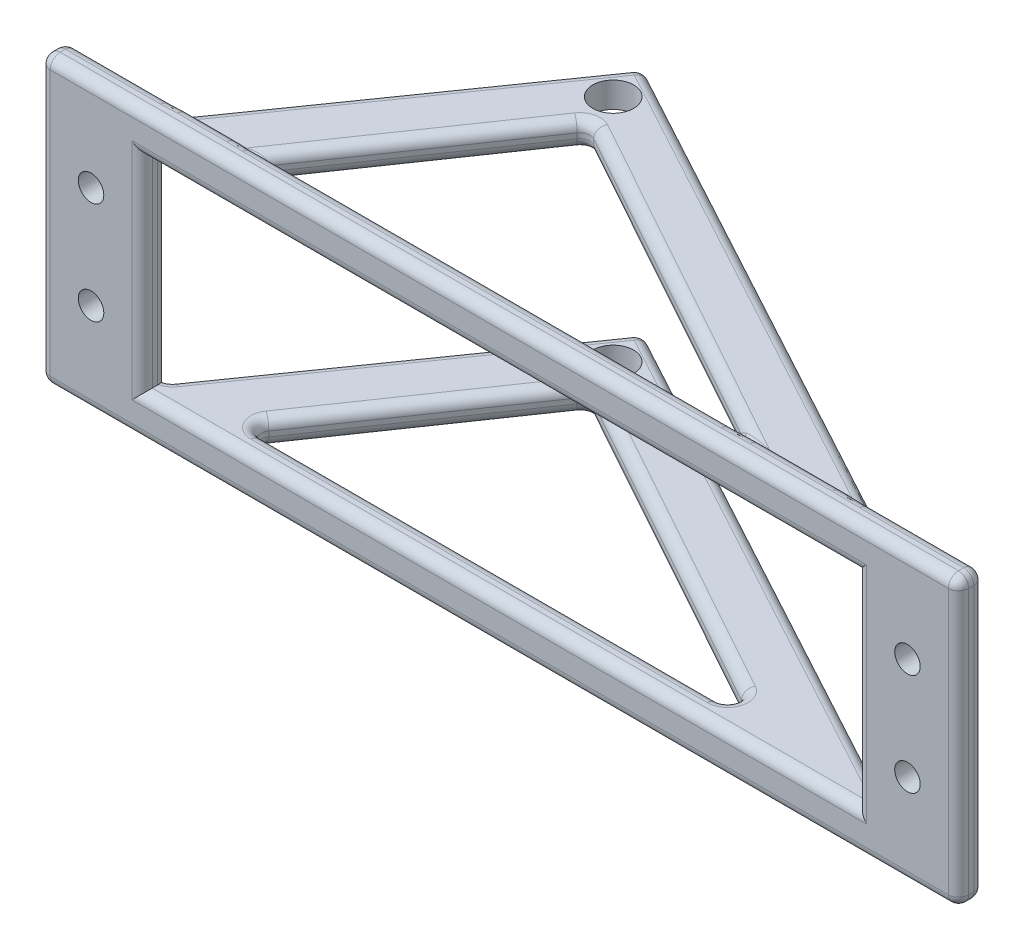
SolidWorks part; units mm, degrees
ref_plane "Front Plane" through (0, 0, 0) normal (0, 0, 1) x (1, 0, 0)
ref_plane "Top Plane" through (0, 0, 0) normal (0, 1, 0) x (1, 0, 0)
ref_plane "Right Plane" through (0, 0, 0) normal (1, 0, 0) x (0, 0, -1)
sketch "Sketch1" plane through (0, 0, 0) normal (0, 0, 1) x (1, 0, 0)
  line L1 (-114.3, 35.56) -> (114.3, 35.56)
  line L2 (-114.3, 35.56) -> (-114.3, -35.56)
  line L3 (-114.3, -35.56) -> (114.3, -35.56)
  line L4 (114.3, 35.56) -> (114.3, -35.56)
  line L5 (-114.3, 35.56) -> (114.3, -35.56) construction
  line L6 (-114.3, -35.56) -> (114.3, 35.56) construction
  point P0 (0, 0)
  dimension "D1" = 228.6
  dimension "D2" = 71.12
extrude "Boss-Extrude1" add sketch "Sketch1" along normal blind 6.35
sketch "Sketch2" plane through (0, 0, 6.35) normal (0, 0, 1) x (1, 0, 0)
  line L0 (-114.3, 0) -> (114.3, 0) construction
  line L1 (114.3, -35.56) -> (114.3, 35.56) construction
  line L2 (0, 0) -> (0, -25.4) construction
  line L3 (-88.9, 25.4) -> (88.9, 25.4)
  line L4 (-88.9, 25.4) -> (-88.9, -25.4)
  line L5 (-88.9, -25.4) -> (88.9, -25.4)
  line L6 (88.9, 25.4) -> (88.9, -25.4)
  line L7 (-88.9, 25.4) -> (88.9, -25.4) construction
  line L8 (-88.9, -25.4) -> (88.9, 25.4) construction
  circle A0 centre (-101.6, 12.7) radius 3.175
  circle A1 centre (-101.6, -12.7) radius 3.175
  circle A2 centre (101.6, -12.7) radius 3.175
  circle A3 centre (101.6, 12.7) radius 3.175
  point P0 (0, 0)
  point P6 (0, 0)
  dimension "D3" = 6.35
  dimension "D1" = 177.8
  dimension "D2" = 50.8
  dimension "D4" = 12.7
  dimension "D5" = 12.7
extrude "Cut-Extrude1" cut sketch "Sketch2" against normal through all
fillet "Fillet1" radius 2.54 12 edges at (88.9, 0, 6.35) (0, -25.4, 6.35) (0, 25.4, 6.35) (-88.9, 0, 6.35) (-114.3, 0, 6.35) (0, 35.56, 6.35) (114.3, 0, 6.35) (0, -35.56, 6.35) (114.3, 35.56, 3.175) (114.3, -35.56, 3.175) (-114.3, -35.56, 3.175) (-114.3, 35.56, 3.175)
ref_plane "Plane1" through (0, -31.75, 0) normal (0, -1, 0) x (-1, 0, 0)
sketch "Sketch3" plane through (0, -31.75, 0) normal (0, -1, 0) x (-1, 0, 0)
  line L0 (0, 0) -> (0, 69.8066) construction
  line L1 (131.9682, 69.8066) -> (-131.9682, 69.8066) construction
  line L2 (88.9, 0) -> (-88.9, 0) construction
  line L3 (111.76, 0) -> (-111.76, 0) construction
  line L4 (88.9, 0) -> (40.0209, 69.8066)
  line L5 (40.0209, 69.8066) -> (-88.9, 0)
  line L6 (70.4256, 0) -> (35.122, 51.367)
  line L7 (35.122, 51.367) -> (-57.7982, 0)
  line L8 (88.9, 0) -> (70.4256, 0)
  line L9 (-57.7982, 0) -> (-88.9, 0)
  line L10 (35.122, 51.367) -> (36.4585, 56.3977) construction
  line L11 (38.7411, 64.9897) -> (40.0209, 69.8066) construction
  point P6 (0, 69.8066)
  point P10 (0, 0)
  point P16 (87.9281, 0)
  dimension "D5" = 25.4
  dimension "D1" = 177.8
  dimension "D2" = 55
  dimension "D3" = 0.5
  dimension "D4" = 0.5
extrude "Boss-Extrude2" add sketch "Sketch3" against normal blind 6.35
ref_plane "Plane2" through (0, 1.905, 0) normal (0, -1, 0) x (-1, 0, 0)
ref_plane "Plane3" through (0, 31.75, 0) normal (0, 1, 0) x (1, 0, 0)
sketch "Sketch5" plane through (0, 31.75, 0) normal (0, 1, 0) x (1, 0, 0)
  line L0 (-88.9, 0) -> (-40.0209, 69.8066)
  line L1 (-40.0209, 69.8066) -> (88.9, 0)
  line L9 (88.9, 0) -> (57.7982, 0)
  line L10 (57.7982, 0) -> (-35.122, 51.367)
  line L11 (-35.122, 51.367) -> (-70.4256, 0)
  line L12 (-70.4256, 0) -> (-88.9, 0)
  point P8 (0, 0)
extrude "Boss-Extrude3" add sketch "Sketch5" against normal blind 6.35
sketch "Sketch7" plane through (0, -31.75, 0) normal (0, -1, 0) x (1, 0, 0)
  line L0 (-35.122, -51.367) -> (-40.0209, -69.8066) construction
  circle A0 centre (-37.209, -59.2225) radius 5.08
  dimension "D1" = 10.16
  dimension "D2" = 8.128
extrude "Cut-Extrude4" cut sketch "Sketch7" against normal blind 177.8
fillet "Fillet10" radius 2.54 30 edges at (-88.9, 28.575, 0) (-88.9, -28.575, 0) (88.9, -28.575, 0) (-79.6628, 31.75, 0) (88.9, 28.575, 0) (-52.7738, -31.75, -25.6835) (-52.7738, -25.4, -25.6835) (-79.6628, -31.75, 0) (-6.3137, -25.4, 0) (73.3491, -31.75, 0) (-52.7738, 25.4, -25.6835) (-52.7738, 31.75, -25.6835) (-6.3137, 25.4, 0) (73.3491, 31.75, 0) (24.4396, -31.75, -34.9033) (-64.4604, -31.75, -34.9033) (-40.0209, -28.575, -69.8066) (-40.0209, 28.575, -69.8066) (-35.122, -28.575, -51.367) (-70.4256, -28.575, 0) (11.3381, -31.75, -25.6835) (11.3381, -25.4, -25.6835) (57.7982, -28.575, 0) (-64.4604, 31.75, -34.9033) (24.4396, 31.75, -34.9033) (-70.4256, 28.575, 0) (-35.122, 28.575, -51.367) (11.3381, 25.4, -25.6835) (11.3381, 31.75, -25.6835) (57.7982, 28.575, 0)
fillet "Fillet11" radius 2.54 10 edges at (-113.5561, -34.8161, 0) (-114.3, 0, 0) (-113.5561, 34.8161, 0) (0, 35.56, 0) (113.5561, 34.8161, 0) (114.3, 0, 0) (113.5561, -34.8161, 0) (88.9, 0, 0) (-88.9, 0, 0) (0, -35.56, 0)
fillet "Fillet12" radius 2.54 14 edges at (-90.8311, -25.4, 0) (-89.0494, -25.4, -0.287) (90.4918, -25.4, 0) (88.9197, -25.4, -0.0778) (25.1522, -25.4, -34.5174) (-39.8226, -25.4, -68.9669) (90.4918, 25.4, 0) (88.9197, 25.4, -0.0778) (-90.8311, 25.4, 0) (-89.0494, 25.4, -0.287) (-64.7306, 25.4, -34.5174) (-39.8226, 25.4, -68.9669) (-64.7306, -25.4, -34.5174) (25.1522, 25.4, -34.5174)
